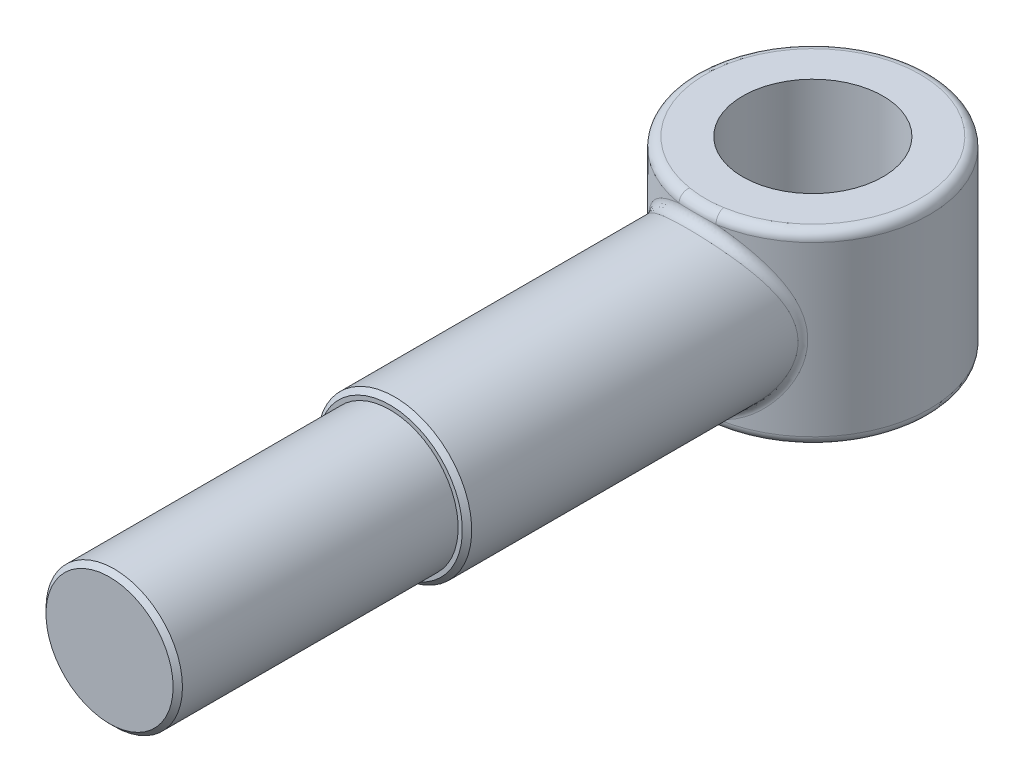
SolidWorks part; units mm, degrees
ref_plane "Plane1" through (0, 0, 0) normal (0, 0, 1) x (1, 0, 0)
ref_plane "Plane2" through (0, 0, 0) normal (0, 1, 0) x (1, 0, 0)
ref_plane "Plane3" through (0, 0, 0) normal (1, 0, 0) x (0, 0, -1)
sketch "Esquisse1" plane through (0, 0, 0) normal (0, 0, 1) x (1, 0, 0)
  circle A0 centre (0, 0) radius 14.6
  dimension "D1" = 29.2
extrude "Base-Extrusion" add sketch "Esquisse1" along normal blind 60
sketch "Esquisse2" plane through (0, 0, 0) normal (0, 0, -1) x (-1, 0, 0)
  circle A0 centre (0, 0) radius 16.5
  dimension "D1" = 33
extrude "Boss.-Extru.1" add sketch "Esquisse2" along normal blind 75
sketch "Esquisse3" plane through (0, 0, 0) normal (0, 1, 0) x (1, 0, 0)
  line L0 (0, -60) -> (0, 0) construction
  line L1 (-14.6, -60) -> (14.6, -60) construction
  circle A0 centre (0, 90.5) radius 25
  dimension "D2" = 50
  dimension "D1" = 150.5
extrude "Boss.-Extru.2" add sketch "Esquisse3" along normal mid plane 40
sketch "Esquisse4" plane through (0, 20, 0) normal (0, 1, 0) x (-1, 0, 0)
  circle A0 centre (0, -90.5) radius 15
  dimension "D1" = 30
extrude "Enlèv. mat.-Extru.1" cut sketch "Esquisse4" against normal through all
fillet "Congé1" radius 2 1 edges at (-16.1172, 3.5337, -71.3888)
chamfer "Chanfrein2" distance 1 angle 45 2 edges at (14.6, 0, 60) (-16.5, 0, 0)
fillet "Congé2" radius 2 3 edges at (-16.901, 3.0127, -72.0784) (0, -20, -65.5) (0, 20, -65.5)
